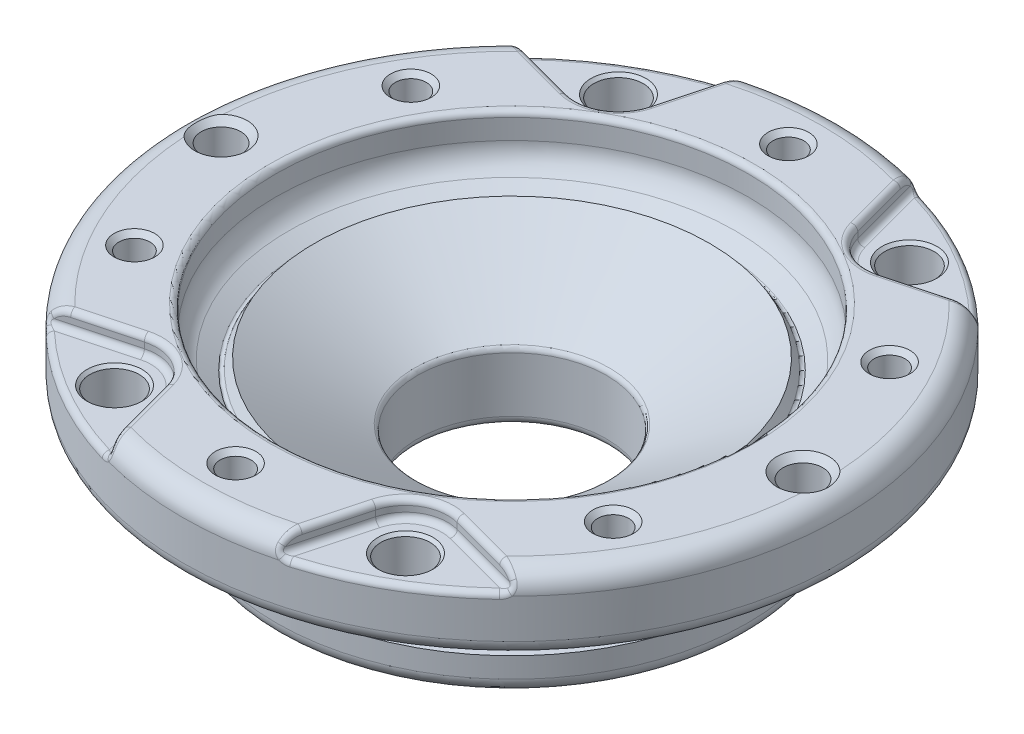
SolidWorks part; units mm, degrees
ref_plane "Front Plane" through (0, 0, 0) normal (0, 0, 1) x (1, 0, 0)
ref_plane "Top Plane" through (0, 0, 0) normal (0, 1, 0) x (1, 0, 0)
ref_plane "Right Plane" through (0, 0, 0) normal (1, 0, 0) x (0, 0, -1)
sketch "Sketch1" plane through (0, 0, 0) normal (1, 0, 0) x (0, 0, -1)
  line L0 (0, 0) -> (0, 47.2033) construction
  line L1 (8.255, 0) -> (20.5867, 0)
  line L2 (20.5867, 0) -> (20.5867, 3.048)
  line L3 (20.5867, 8.636) -> (28.7655, 8.636)
  line L4 (28.7655, 8.636) -> (28.7655, 15.113)
  line L5 (28.7655, 15.113) -> (20.6375, 15.113)
  line L6 (20.6375, 15.113) -> (20.6375, 11.539)
  line L7 (17.2514, 11.0505) -> (8.255, 5.8564)
  line L9 (8.89, 6.223) -> (0, 6.223) construction
  line L10 (17.2514, 11.0505) -> (17.8864, 9.9506)
  line L11 (17.8864, 9.9506) -> (20.6375, 11.539)
  line L12 (17.2514, 11.0505) -> (20.6375, 13.0054) construction
  line L13 (20.5867, 3.048) -> (18.5547, 3.048)
  line L14 (18.5547, 3.048) -> (18.5547, 6.1259)
  line L15 (18.5547, 6.1259) -> (20.5867, 6.1259)
  line L16 (20.5867, 6.1259) -> (20.5867, 8.636)
  line L17 (0, 3.937) -> (8.5315, 6.223) construction
  line L18 (8.5315, 6.223) -> (14.3268, 15.113) construction
  line L19 (14.3268, 15.113) -> (32.7253, 32.5726) construction
  line L20 (24.384, 4.9063) -> (24.384, 14.4462) construction
  line L21 (26.1366, 4.5861) -> (26.1366, 14.4462) construction
  line L22 (22.6314, 4.9063) -> (22.6314, 14.4462) construction
  line L24 (24.384, 4.9063) -> (24.384, 14.4462) construction
  line L26 (26.1366, 4.9063) -> (26.1366, 14.4462) construction
  line L28 (8.255, 0) -> (8.255, 5.8564)
  circle A0 centre (18.2118, 11.165) radius 0.889 construction
  circle A1 centre (0, -26.628) radius 44.45 construction
  point P17 (17.3228, 11.165)
  dimension "D9" = 1.778
  dimension "D12" = 88.9
  dimension "D1" = 41.1734
  dimension "D4" = 60
  dimension "D5" = 8.89
  dimension "D6" = 16.51
  dimension "D7" = 1.27
  dimension "D8" = 3.1767
  dimension "D10" = 34.6456
  dimension "D11" = 2.1076
  dimension "D13" = 3.048
  dimension "D14" = 3.0779
  dimension "D15" = 8.636
  dimension "D16" = 57.531
  dimension "D17" = 8.1788
  dimension "D18" = 75
  dimension "D19" = 33.1
  dimension "D20" = 46.5
  dimension "D21" = 37.1094
  dimension "D22" = 6.477
  dimension "D25" = 2.032
  dimension "D27" = 48.768
  dimension "D28" = 2.5101
  dimension "D29" = 6.7824
  dimension "D30" = 2.286
  dimension "D31" = 5.7999
  dimension "D32" = 6.223
  dimension "D33" = 17.78
  dimension "D36" = 41.275
  dimension "D23" = 1.7526
  dimension "D24" = 1.7526
revolve "Revolve1" add sketch "Sketch1" angle 360 about L0
sketch "Sketch10" plane through (0, 0, 0) normal (0, -1, 0) x (1, 0, 0)
  circle A0 centre (0, 0) radius 18.5547
  circle A1 centre (0, 0) radius 20.5867 construction
  circle A2 centre (0, 0) radius 20.5867
  dimension "D1" = 2.032
extrude "Boss-Extrude1" [suppressed] add sketch "Sketch10" along normal blind 0.254
fillet "Fillet1" [suppressed] radius 0.762
fillet "Fillet2" radius 0.508 4 edges at (0, 3.048, -18.5547) (0, 6.1259, -18.5547) (0, 15.113, -20.6375) (0, 5.8564, -8.255)
fillet "Fillet3" radius 0.254 1 edges at (0, 9.9506, -17.8864)
fillet "Fillet4" radius 2.286 1 edges at (0, 11.539, -20.6375)
fillet "Fillet5" [suppressed] radius 0.127
fillet "Fillet6" radius 1.778 1 edges at (0, 15.113, -28.7655)
fillet "Fillet7" radius 1.27 1 edges at (0, 8.636, -28.7655)
hole_wizard "CBORE for #8 Socket Head Cap Screw2" positions "Sketch4" profile "Sketch5" counterbore size "#8" standard "ANSI Inch"
sketch "Sketch4" plane through (0, 15.113, 0) normal (0, 1, 0) x (1, 0, 0)
  line L0 (0, 39.8634) -> (0, 0) construction
  line L1 (0, 0) -> (12.7, 21.997) construction
  circle A0 centre (0, 0) radius 25.4 construction
  point P0 (12.7, 21.997)
  point P20 (12.7, -21.997)
  point P21 (-12.7, -21.997)
  point P23 (-12.7, 21.997)
  point P33 (25.4, 0)
  point P34 (-25.4, 0)
  dimension "D2" = 50.8
  dimension "D1" = 30
  dimension "D3" = 6
sketch "Sketch5" plane through (12.7, 15.113, -21.997) normal (1, 0, 0) x (0, 0, 1)
  line L0 (0, 0) -> (0, 15.113)
  line L1 (0, 15.113) -> (2.1526, 15.113)
  line L3 (2.1526, 15.113) -> (2.1527, 1.524)
  line L4 (2.1527, 1.524) -> (3.683, 1.524)
  line L5 (3.683, 1.524) -> (3.683, 0)
  line L7 (3.683, 0) -> (0, 0)
  line L11 (0, -6.35) -> (0, 107.95) construction
  dimension "Thru Hole Dia." = 4.3053
  dimension "Thru Hole Depth" = 15.113
  dimension "C'Bore Dia." = 7.366
  dimension "C'Bore Depth" = 1.524
hole_wizard "#6-32 Tapped Hole1" positions "Sketch6" profile "Sketch7" tap size "#6-32" standard "ANSI Inch"
sketch "Sketch6" plane through (0, 15.113, 0) normal (0, 1, 0) x (1, 0, 0)
  circle A0 centre (0, 0) radius 24.13 construction
  point P0 (0, 24.13)
  point P12 (20.8972, 12.065)
  point P13 (20.8972, -12.065)
  point P14 (0, -24.13)
  point P15 (-20.8972, -12.065)
  point P16 (-20.8972, 12.065)
  dimension "D1" = 48.26
  dimension "D2" = 6
sketch "Sketch7" plane through (0, 15.113, -24.13) normal (1, 0, 0) x (0, 0, 1)
  line L0 (0, 0) -> (0, 6.477)
  line L1 (0, 6.477) -> (1.778, 6.477)
  line L2 (1.3525, 6.0515) -> (1.3525, 0.4254)
  line L3 (1.3525, 0.4254) -> (1.778, 0)
  line L5 (1.778, 0) -> (0, 0)
  line L6 (-1.3525, 0.4254) -> (-1.778, 0) construction
  line L7 (1.778, 6.477) -> (1.3525, 6.0515)
  line L8 (-1.778, 6.477) -> (-1.3526, 6.0515) construction
  line L11 (0, -6.35) -> (0, 107.95) construction
  dimension "Thru Tap Drill Dia." = 2.7051
  dimension "Thru Tap Drill Depth" = 6.477
  dimension "Near C'Sink Dia." = 3.556
  dimension "Near C'Sink Angle" = 90
  dimension "Far C'Sink Dia." = 3.556
  dimension "Far C'Sink Angle" = 90
sketch "Sketch8" plane through (0, 0, 0) normal (1, 0, 0) x (0, 0, -1)
  line L0 (0, 0) -> (0, 32.7646) construction
  line L1 (-26.67, 15.113) -> (-28.7655, 9.3557)
  line L2 (-18.314, 15.113) -> (-24.8929, 15.113) construction
  line L3 (-28.7655, 13.335) -> (-28.7655, 9.906) construction
  line L4 (-28.7655, 9.3557) -> (-28.7655, 18.6908)
  line L5 (-28.7655, 18.6908) -> (-26.67, 15.113)
  line L6 (21.1455, 15.113) -> (-21.1455, 15.113) construction
  dimension "D1" = 53.34
  dimension "D2" = 70
revolve "Cut-Revolve1" [suppressed] cut sketch "Sketch8" angle 360 about L0
fillet "Fillet8" [suppressed] radius 1.27
fillet "Fillet9" [suppressed] radius 2.54
chamfer "Chamfer1" [suppressed] distance 0.508 angle 45
sketch "Sketch9" plane through (0, 13.589, 0) normal (0, 1, 0) x (1, 0, 0)
  line L0 (12.7, 21.997) -> (16.9955, 29.437) construction
  line L1 (9.1425, 21.0438) -> (5.0448, 36.3368)
  line L2 (13.6532, 18.4395) -> (28.9462, 22.5373)
  line L3 (5.0448, 36.3368) -> (28.9462, 22.5373)
  line L6 (9.1425, 21.0438) -> (16.0067, -4.5736) construction
  line L9 (22.7957, 2.6043) -> (33.9909, 13.7995)
  line L12 (22.7957, -2.6043) -> (33.9909, -13.7995)
  line L15 (33.9909, 13.7995) -> (33.9909, -13.7995)
  line L18 (25.4, 0) -> (33.9909, 0) construction
  line L21 (13.6532, -18.4395) -> (28.9462, -22.5373)
  line L24 (9.1425, -21.0438) -> (5.0448, -36.3368)
  line L25 (28.9462, -22.5373) -> (5.0448, -36.3368)
  line L26 (12.7, -21.997) -> (16.9955, -29.437) construction
  line L27 (-9.1425, -21.0438) -> (-5.0448, -36.3368)
  line L28 (-13.6532, -18.4395) -> (-28.9462, -22.5373)
  line L29 (-5.0448, -36.3368) -> (-28.9462, -22.5373)
  line L30 (-12.7, -21.997) -> (-16.9955, -29.437) construction
  line L31 (-22.7957, -2.6043) -> (-33.9909, -13.7995)
  line L32 (-22.7957, 2.6043) -> (-33.9909, 13.7995)
  line L33 (-33.9909, -13.7995) -> (-33.9909, 13.7995)
  line L34 (-25.4, 0) -> (-33.9909, 0) construction
  line L35 (-13.6532, 18.4395) -> (-28.9462, 22.5373)
  line L36 (-9.1425, 21.0438) -> (-5.0448, 36.3368)
  line L37 (-28.9462, 22.5373) -> (-5.0448, 36.3368)
  line L38 (-12.7, 21.997) -> (-16.9955, 29.437) construction
  arc A0 (9.1425, 21.0438) -> (13.6532, 18.4395) centre (12.7, 21.997) ccw
  arc A2 (22.7957, 2.6043) -> (22.7957, -2.6043) centre (25.4, 0) ccw
  arc A17 (13.6532, -18.4395) -> (9.1425, -21.0438) centre (12.7, -21.997) ccw
  arc A18 (-9.1425, -21.0438) -> (-13.6532, -18.4395) centre (-12.7, -21.997) ccw
  arc A19 (-22.7957, -2.6043) -> (-22.7957, 2.6043) centre (-25.4, 0) ccw
  arc A20 (-13.6532, 18.4395) -> (-9.1425, 21.0438) centre (-12.7, 21.997) ccw
  point P13 (32.2047, 0)
  point P16 (-32.2047, 0)
  point P43 (0, 0)
  point P63 (0, 0)
  point P69 (-32.2047, 0)
  point P76 (32.2047, 0)
  point P83 (-32.2047, 0)
  point P90 (32.2047, 0)
  point P97 (-32.2047, 0)
  point P104 (32.2047, 0)
  point P111 (-32.2047, 0)
  point P118 (32.2047, 0)
  point P125 (-32.2047, 0)
  point P132 (32.2047, 0)
  point P139 (-32.2047, 0)
  point P146 (32.2047, 0)
  dimension "D2" = 3.683
  dimension "D1" = 90
  dimension "D3" = 6
extrude "Cut-Extrude1" cut sketch "Sketch9" along normal through all
fillet "Fillet10" radius 0.508 16 edges at (10.8585, 13.589, -18.8075) (10.8585, 13.589, 18.8075) (-10.8585, 13.589, 18.8075) (-10.8585, 13.589, -18.8075) (-8.2378, 13.589, -24.42) (-7.4713, 14.5504, -27.2806) (-17.0294, 13.589, -19.3442) (-17.0294, 13.589, 19.3442) (-19.89, 14.5504, 20.1107) (-8.2378, 13.589, 24.42) (8.2378, 13.589, 24.42) (7.4713, 14.5504, 27.2806) (17.0294, 13.589, 19.3442) (17.0294, 13.589, -19.3442) (19.89, 14.5504, -20.1107) (8.2378, 13.589, -24.42)
chamfer "Chamfer2" [suppressed] distance 0.508 angle 45
fillet "Fillet11" radius 0.508 32 edges at (10.8585, 15.113, 18.8075) (16.0395, 15.113, 19.0789) (18.8322, 15.0766, 19.8272) (7.4713, 14.5504, 27.2806) (-8.5031, 15.113, 23.4301) (-7.7548, 15.0766, 26.2228) (-19.89, 14.5504, 20.1107) (-16.0395, 15.113, 19.0789) (-18.8322, 15.0766, -19.8272) (-7.4713, 14.5504, -27.2806) (-8.5031, 15.113, -23.4301) (-10.8585, 15.113, -18.8075) (8.5031, 15.113, -23.4301) (7.7548, 15.0766, -26.2228) (19.89, 14.5504, -20.1107) (16.0395, 15.113, -19.0789) (8.5031, 15.113, 23.4301) (-10.8585, 15.113, 18.8075) (-16.0395, 15.113, -19.0789) (10.8585, 15.113, -18.8075) (20.2597, 13.7504, 20.3512) (14.3736, 13.589, 24.8959) (7.4561, 13.7959, 27.7194) (-7.4948, 13.7504, 27.721) (-14.3736, 13.589, 24.8959) (-20.2777, 13.7959, 20.3169) (-20.2597, 13.7504, -20.3512) (-14.3736, 13.589, -24.8959) (-7.4561, 13.7959, -27.7194) (7.4948, 13.7504, -27.721) (14.3736, 13.589, -24.8959) (20.2777, 13.7959, -20.3169)
chamfer "Chamfer3" distance 0.254 angle 45 16 edges at (0, 8.636, 27.4955) (11.6237, 8.636, 20.1328) (12.7, 13.589, 24.1497) (27.4955, 8.636, 0) (11.6237, 8.636, -20.1328) (12.7, 13.589, -19.8444) (0, 8.636, -27.4955) (-11.6237, 8.636, -20.1328) (-12.7, 13.589, -19.8444) (-27.4955, 8.636, 0) (-11.6237, 8.636, 20.1328) (-12.7, 13.589, 24.1497)
fillet "Fillet12" [suppressed] radius 0.762
hole_wizard "M2x0.4 Tapped Hole1" positions "Sketch2" profile "Sketch3" tap size "M2x0.4" standard "ANSI Metric"
sketch "Sketch2" plane through (0, 0, 0) normal (0, -1, 0) x (-1, 0, 0)
  line L0 (0, 0) -> (15.5784, 0) construction
  point P0 (10.5, -12.4001)
  point P3 (-10.5, -12.4001)
  point P6 (-10.5, 0.0999)
  point P9 (10.5, 0.0999)
sketch "Sketch3" plane through (-10.5, 0, 12.4001) normal (1, 0, 0) x (0, 0, -1)
  line L0 (0, 0) -> (0, 5.0527)
  line L1 (0, 5.0527) -> (0.8, 4.572)
  line L2 (0.8, 4.572) -> (0.8, 0.225)
  line L3 (0.8, 0.225) -> (1.025, 0)
  line L5 (1.025, 0) -> (0, 0)
  line L6 (-0.8, 0.225) -> (-1.025, 0) construction
  line L10 (0, 5.0527) -> (-0.8, 4.572) construction
  line L11 (0, -6.35) -> (0, 107.95) construction
  dimension "Tap Drill Dia." = 1.6
  dimension "Tap Drill Depth" = 4.572
  dimension "Near C'Sink Dia." = 2.05
  dimension "Near C'Sink Angle" = 90
  dimension "Drill Angle" = 118
sketch "Sketch11" plane through (0, 0, 0) normal (0, -1, 0) x (1, 0, 0)
  line L0 (-18.3793, 0) -> (0, 0) construction
  line L1 (-10.795, 15.24) -> (10.795, 15.24)
  line L2 (-13.335, 12.7) -> (-13.335, -7.7618)
  line L3 (-10.795, -10.3018) -> (10.795, -10.3018)
  line L4 (13.335, 12.7) -> (13.335, -7.7618)
  line L5 (-13.335, 15.24) -> (13.335, -10.3018) construction
  line L6 (-13.335, -10.3018) -> (13.335, 15.24) construction
  line L7 (0, 0) -> (0, 15.4001) construction
  line L8 (-12.5, 2.4691) -> (-17.1301, 2.4691) construction
  line L9 (-12.5, -7.4619) -> (-12.5, 12.4001) construction
  arc A0 (-13.335, -7.7618) -> (-10.795, -10.3018) centre (-10.795, -7.7618) ccw
  circle A1 centre (0, 0) radius 20.5867
  circle A2 centre (0, 0) radius 20.5867
  arc A3 (10.795, -10.3018) -> (13.335, -7.7618) centre (10.795, -7.7618) ccw
  arc A4 (10.795, 15.24) -> (13.335, 12.7) centre (10.795, 12.7) cw
  arc A5 (-10.795, 15.24) -> (-13.335, 12.7) centre (-10.795, 12.7) ccw
  dimension "D4" = 2.54
  dimension "D2" = 26.67
  dimension "D5" = 15.24
  dimension "D1" = 0
extrude "Boss-Extrude2" [suppressed] add sketch "Sketch11" along normal blind 1.6002
fillet "Fillet13" [suppressed] radius 0.762
sketch "Sketch12" [suppressed] plane through (0, 0, 0) normal (0, -1, 0) x (1, 0, 0)
  line L0 (-8.595, 12.4001) -> (-8.595, 15.24)
  line L1 (-10.5, 10.4951) -> (-13.335, 10.4951)
  line L2 (-13.335, 12.7) -> (-13.335, -7.7618) construction
  line L3 (10.795, 15.24) -> (-10.795, 15.24) construction
  line L4 (-8.595, 15.24) -> (-10.795, 15.24)
  line L5 (-13.335, 12.7) -> (-13.335, 10.4951)
  line L6 (0, 0) -> (0, 17.4165) construction
  line L7 (-10.5, 12.4001) -> (-16.2274, 18.1276) construction
  line L8 (10.5, 12.4001) -> (16.2274, 18.1276) construction
  line L9 (13.335, 12.7) -> (13.335, 10.4951)
  line L10 (8.595, 15.24) -> (10.795, 15.24)
  line L11 (10.5, 10.4951) -> (13.335, 10.4951)
  line L12 (8.595, 12.4001) -> (8.595, 15.24)
  line L13 (-10.5, 1.8051) -> (-13.335, 1.8051)
  line L14 (-13.335, 1.8051) -> (-13.335, -2.0049)
  line L15 (-13.335, -2.0049) -> (-10.5, -2.0049)
  line L16 (13.335, -2.0049) -> (10.5, -2.0049)
  line L17 (13.335, 1.8051) -> (13.335, -2.0049)
  line L18 (10.5, 1.8051) -> (13.335, 1.8051)
  arc A0 (-10.5, 10.4951) -> (-8.595, 12.4001) centre (-10.5, 12.4001) ccw
  arc A3 (-10.5, -2.0049) -> (-10.5, 1.8051) centre (-10.5, -0.0999) ccw
  arc A4 (-10.795, 15.24) -> (-13.335, 12.7) centre (-10.795, 12.7) ccw construction
  arc A5 (-10.795, 15.24) -> (-13.335, 12.7) centre (-10.795, 12.7) ccw
  arc A6 (10.795, 15.24) -> (13.335, 12.7) centre (10.795, 12.7) cw
  arc A7 (10.5, -2.0049) -> (10.5, 1.8051) centre (10.5, -0.0999) cw
  arc A8 (10.5, 10.4951) -> (8.595, 12.4001) centre (10.5, 12.4001) cw
  dimension "D1" = 3.81
  dimension "D2" = 45
  dimension "D3" = 90
extrude "Boss-Extrude3" [suppressed] add sketch "Sketch12" along normal up to surface (1.6002 mm away) contours L1 A0 L0 M10 M11 M12 M13 | A3 M16 | A7 M15 | A8 L11 L12 M8 M9 M10 M14
fillet "Fillet14" [suppressed] radius 1.6002
fillet "Fillet15" radius 1.27 1 edges at (0, 0, -20.5867)
fillet "Fillet16" radius 0.762 2 edges at (0, 0, -8.255) (0, 8.636, -20.5867)
hole_wizard "#8-32 Tapped Hole1" positions "Sketch13" profile "Sketch14" tap size "#8-32" standard "ANSI Inch"
sketch "Sketch13" plane through (0, 15.113, 0) normal (0, 1, 0) x (1, 0, 0)
  line L0 (0, 42.2492) -> (0, 0) construction
  line L1 (0, 0) -> (37.8019, 0) construction
  circle A0 centre (0, 0) radius 25.4 construction
  circle A1 centre (0, 0) radius 25.4
  point P0 (25.4, 0)
  point P14 (-25.4, 0)
sketch "Sketch14" plane through (25.4, 15.113, 0) normal (1, 0, 0) x (0, 0, 1)
  line L0 (0, 0) -> (0, 6.477)
  line L1 (0, 6.477) -> (2.286, 6.477)
  line L2 (1.7272, 5.9182) -> (1.7272, 0.5588)
  line L3 (1.7272, 0.5588) -> (2.286, 0)
  line L5 (2.286, 0) -> (0, 0)
  line L6 (-1.7272, 0.5588) -> (-2.286, 0) construction
  line L7 (2.286, 6.477) -> (1.7272, 5.9182)
  line L8 (-2.286, 6.477) -> (-1.7272, 5.9182) construction
  line L11 (0, -6.35) -> (0, 107.95) construction
  dimension "Thru Tap Drill Dia." = 3.4544
  dimension "Thru Tap Drill Depth" = 6.477
  dimension "Near C'Sink Dia." = 4.572
  dimension "Near C'Sink Angle" = 90
  dimension "Far C'Sink Dia." = 4.572
  dimension "Far C'Sink Angle" = 90
